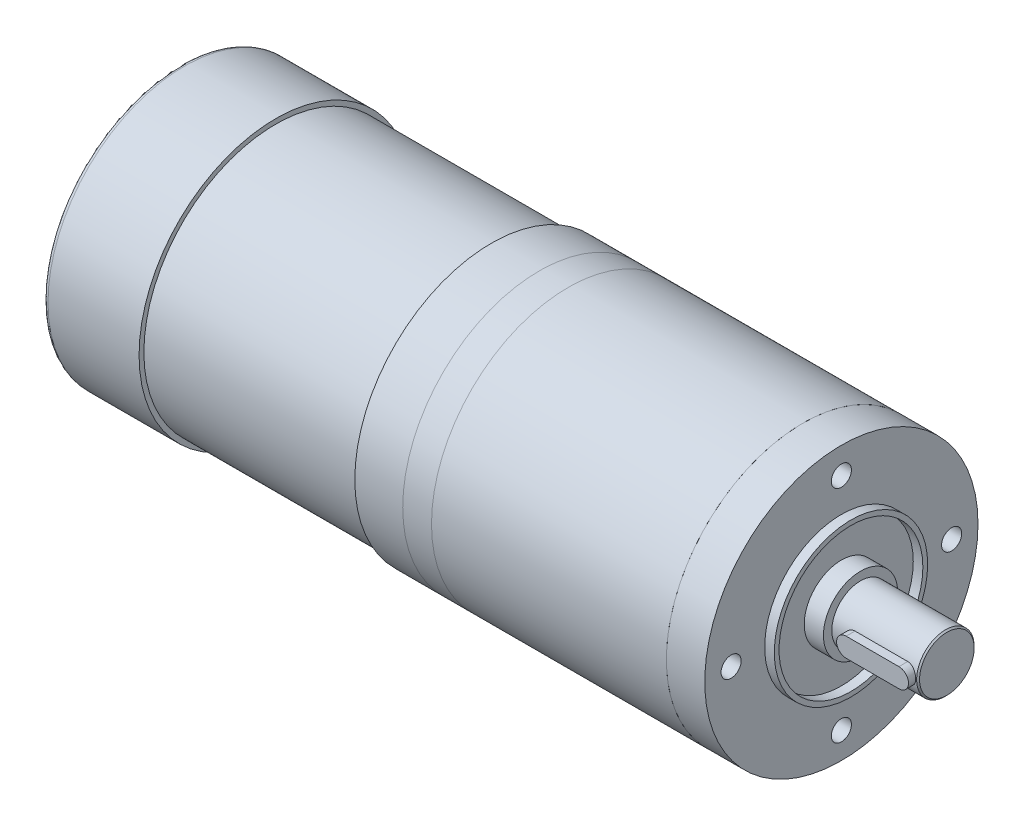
SolidWorks part; units mm, degrees
ref_plane "前视基准面" through (0, 0, 0) normal (0, 0, 1) x (1, 0, 0)
ref_plane "上视基准面" through (0, 0, 0) normal (0, 1, 0) x (1, 0, 0)
ref_plane "右视基准面" through (0, 0, 0) normal (1, 0, 0) x (0, 0, -1)
sketch "草图1" plane through (0, 0, 0) normal (1, 0, 0) x (0, 0, -1)
  circle A0 centre (0, 0) radius 28.5
extrude "凸台-拉伸1" add sketch "草图1" against normal blind 8
sketch "草图2" plane through (-8, 0, 0) normal (-1, 0, 0) x (0, 0, 1)
  circle A0 centre (0, 0) radius 28.5
extrude "凸台-拉伸2" add sketch "草图2" along normal blind 49 separate body
sketch "草图3" plane through (-57, 0, 0) normal (-1, 0, 0) x (0, 0, 1)
  circle A0 centre (0, 0) radius 28.5
extrude "凸台-拉伸3" add sketch "草图3" along normal blind 6 separate body
sketch "草图4" plane through (-63, 0, 0) normal (-1, 0, 0) x (0, 0, 1)
  circle A0 centre (0, 0) radius 28.5
extrude "凸台-拉伸4" add sketch "草图4" along normal blind 10 separate body
sketch "草图5" plane through (-73, 0, 0) normal (-1, 0, 0) x (0, 0, 1)
  circle A0 centre (0, 0) radius 27.5
extrude "凸台-拉伸5" add sketch "草图5" along normal blind 45
sketch "草图6" plane through (-118, 0, 0) normal (-1, 0, 0) x (0, 0, 1)
  circle A0 centre (0, 0) radius 28.5
extrude "凸台-拉伸6" add sketch "草图6" along normal blind 20
fillet "圆角1" radius 1 1 edges at (-138, 0, 28.5)
sketch "草图7" plane through (0, 0, 0) normal (1, 0, 0) x (0, 0, -1)
  circle A0 centre (0, 0) radius 16
  circle A1 centre (0, 0) radius 15
extrude "凸台-拉伸7" add sketch "草图7" along normal blind 2
sketch "草图8" plane through (0, 0, 0) normal (1, 0, 0) x (0, 0, -1)
  circle A0 centre (0, 0) radius 7.75
extrude "凸台-拉伸8" add sketch "草图8" along normal blind 4
sketch "草图9" plane through (4, 0, 0) normal (1, 0, 0) x (0, 0, -1)
  circle A0 centre (0, 0) radius 6
extrude "凸台-拉伸9" add sketch "草图9" along normal blind 18
sketch "草图10" plane through (0, 0, 0) normal (1, 0, 0) x (0, 0, -1)
  point P3 (0, 23)
  point P4 (23, 0)
  point P5 (0, -23)
  point P6 (-23, 0)
hole_wizard "M5 螺纹孔1" positions "3D草图1" profile "草图11" tap size "M5" standard "GB"
sketch3d "3D草图1"
  point P0 (0, 23, 0)
  point P3 (0, 0, -23)
  point P6 (0, -23, 0)
  point P9 (0, 0, 23)
sketch "草图11" plane through (0, 23, 0) normal (0, 1, 0) x (0, 0, -1)
  line L0 (0, 0) -> (0, 15.2618)
  line L1 (0, 15.2618) -> (2.1, 14)
  line L2 (2.1, 14) -> (2.1, 0)
  line L5 (2.1, 0) -> (0, 0)
  line L10 (0, 15.2618) -> (-2.1, 14) construction
  line L11 (0, -6.35) -> (0, 107.95) construction
  dimension "螺纹孔钻头直径" = 4.2
  dimension "螺纹孔钻头深度" = 14
  dimension "导头角度" = 118
ref_plane "基准面1" through (0, 0, 6) normal (0, 0, 1) x (1, 0, 0)
sketch "草图12" plane through (0, 0, 6) normal (0, 0, 1) x (1, 0, 0)
  line L3 (8.5, 2) -> (19.5, 2)
  line L5 (19.5, -2) -> (8.5, -2)
  arc A0 (19.5, -2) -> (19.5, 2) centre (19.5, 0) ccw
  arc A1 (8.5, 2) -> (8.5, -2) centre (8.5, 0) ccw
extrude "切除-拉伸1" cut sketch "草图12" against normal blind 2.5
sketch "草图13" plane through (0, 0, 3.5) normal (0, 0, 1) x (1, 0, 0)
  line L0 (8.5, 2) -> (19.5, 2)
  line L2 (19.5, -2) -> (8.5, -2)
  arc A0 (8.5, 2) -> (8.5, -2) centre (8.5, 0) ccw
  arc A1 (19.5, -2) -> (19.5, 2) centre (19.5, 0) ccw
extrude "凸台-拉伸10" add sketch "草图13" along normal blind 4 separate body
chamfer "倒角1" distance 0.3 angle 45 1 edges at (22, 0, -6)
